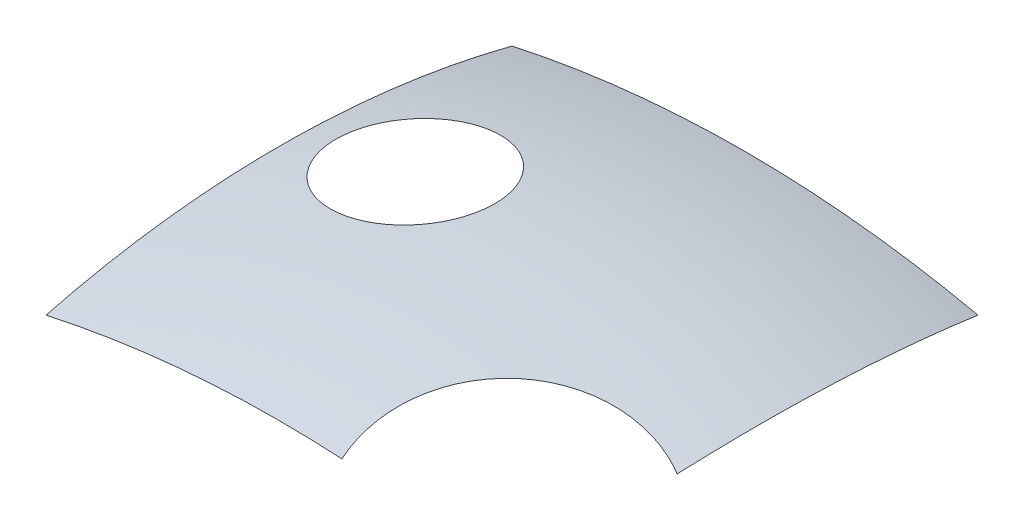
SolidWorks part; units mm, degrees
ref_plane "Front" through (0, 0, 0) normal (0, 0, 1) x (1, 0, 0)
ref_plane "Top" through (0, 0, 0) normal (0, 1, 0) x (1, 0, 0)
ref_plane "Right" through (0, 0, 0) normal (1, 0, 0) x (0, 0, -1)
sketch "Sketch1" plane through (0, 0, 0) normal (0, 0, -1) x (1, 0, 0)
  arc A0 (0, 0) -> (150, 0) centre (75, 341.8699) ccw
  dimension "D2" = 350
  dimension "D1" = 150
sketch "Sketch2" plane through (0, 0, 0) normal (1, 0, 0) x (0, 0, -1)
  arc A0 (0, 0) -> (-150, 0) centre (-75, -290.4738) ccw
  dimension "D1" = 150
  dimension "D2" = 300
surface "Surface-Sweep2"
sketch "Sketch3" plane through (0, 0, 0) normal (0, 1, 0) x (1, 0, 0)
  circle A0 centre (135.0796, -137.7512) radius 41.6905
  circle A1 centre (33.3713, -64.5026) radius 24.6523
surface "Surface-Trim1"
sketch "Sketch4" plane through (0, 0, 0) normal (0, 1, 0) x (1, 0, 0)
  line L0 (153.9258, -84.4261) -> (115.5408, -20.8612)
  line L1 (115.5408, -20.8612) -> (75, 0)
  line L2 (150, 0) -> (0, 0) construction
  ellipse E0 centre (28.403, -75) end of major axis (28.403, -375) minor radius 125.5848 (153.538, -100.3696) -> (150, 0) ccw construction
